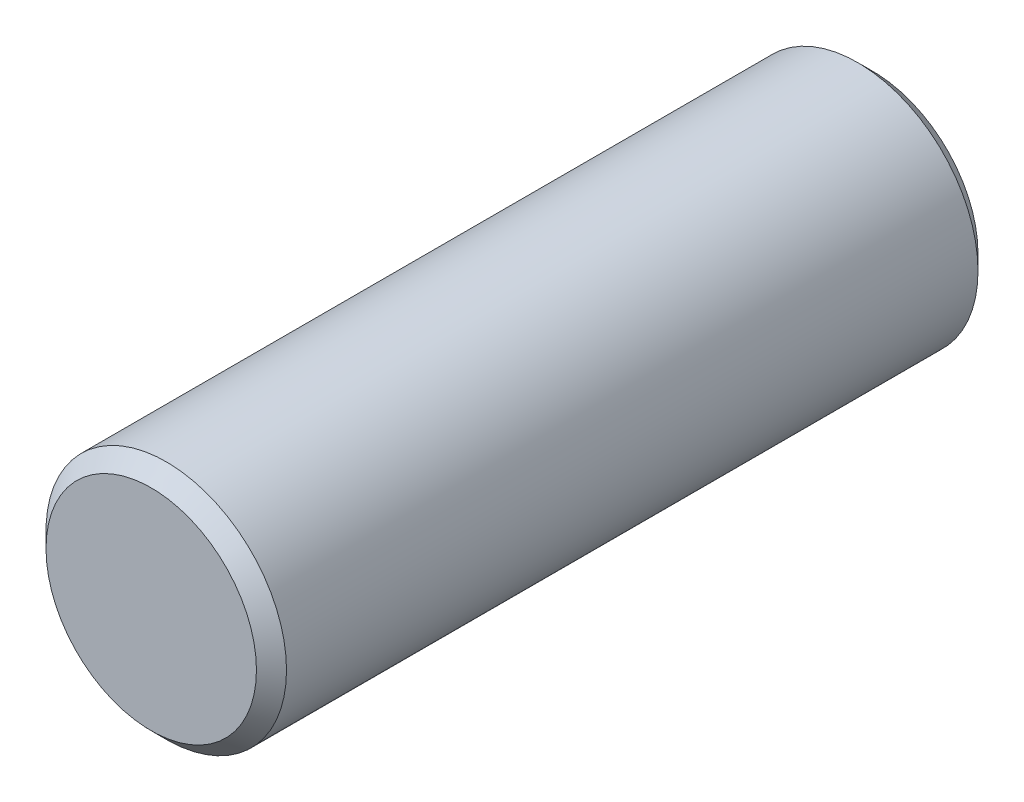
SolidWorks part; units mm, degrees
ref_plane "Спереди" through (0, 0, 0) normal (0, 0, 1) x (1, 0, 0)
ref_plane "Сверху" through (0, 0, 0) normal (0, 1, 0) x (1, 0, 0)
ref_plane "Справа" through (0, 0, 0) normal (1, 0, 0) x (0, 0, -1)
sketch "Эскиз1" plane through (0, 0, 0) normal (0, 0, 1) x (1, 0, 0)
  circle A0 centre (0, 0) radius 2
  dimension "D1" = 4
extrude "Бобышка-Вытянуть1" add sketch "Эскиз1" along normal blind 12
chamfer "Фаска1" distance 0.25 angle 45 2 edges at (2, 0, 0) (2, 0, 12)
